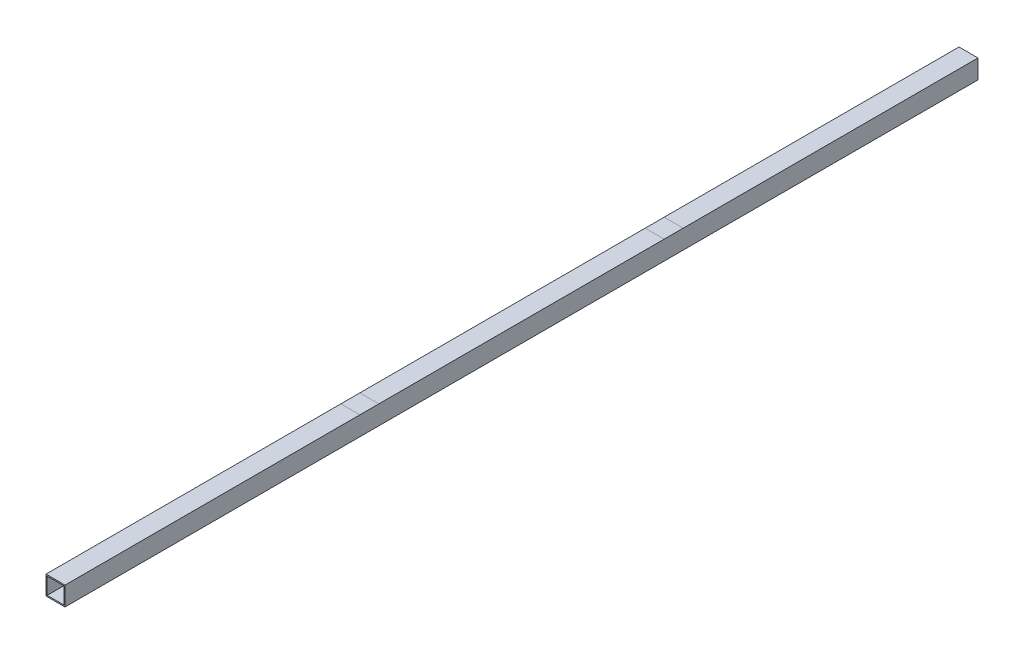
SolidWorks part; units mm, degrees
ref_plane "Plan de face" through (0, 0, 0) normal (0, 0, 1) x (1, 0, 0)
ref_plane "Plan de dessus" through (0, 0, 0) normal (0, 1, 0) x (1, 0, 0)
ref_plane "Plan de droite" through (0, 0, 0) normal (1, 0, 0) x (0, 0, -1)
sketch "Esquisse1" plane through (0, 0, 0) normal (0, 0, 1) x (1, 0, 0)
  line L1 (-35, 35) -> (35, 35)
  line L2 (-35, 35) -> (-35, -35)
  line L3 (-35, -35) -> (35, -35)
  line L4 (35, 35) -> (35, -35)
  line L5 (-40, 40) -> (40, 40)
  line L6 (-40, 40) -> (-40, -40)
  line L7 (-40, -40) -> (40, -40)
  line L8 (40, 40) -> (40, -40)
  dimension "D1" = 80
  dimension "D2" = 80
  dimension "D3" = 40
  dimension "D4" = 40
  dimension "D5" = 5
  dimension "D6" = 5
  dimension "D7" = 5
  dimension "D8" = 5
extrude "Boss.-Extru.1" add sketch "Esquisse1" along normal blind 3840
sketch "Esquisse2" plane through (0, 40, 0) normal (0, 1, 0) x (1, 0, 0)
  line L1 (-40, -2600) -> (40, -2600)
  line L2 (-40, -2600) -> (-40, -2520)
  line L3 (-40, -2520) -> (40, -2520)
  line L4 (40, -2600) -> (40, -2520)
  line L6 (-40, -3840) -> (-40, 0) construction
  line L10 (40, -3840) -> (40, 0) construction
  dimension "D1" = 40
  dimension "D2" = 40
sketch "Esquisse3" plane through (0, 40, 0) normal (0, 1, 0) x (1, 0, 0)
  line L1 (-40, -1320) -> (40, -1320)
  line L2 (-40, -1320) -> (-40, -1240)
  line L3 (-40, -1240) -> (40, -1240)
  line L4 (40, -1320) -> (40, -1240)
  line L6 (-40, -3840) -> (-40, 0) construction
  line L7 (40, -3840) -> (40, 0) construction
  dimension "D1" = 40
  dimension "D2" = 40
